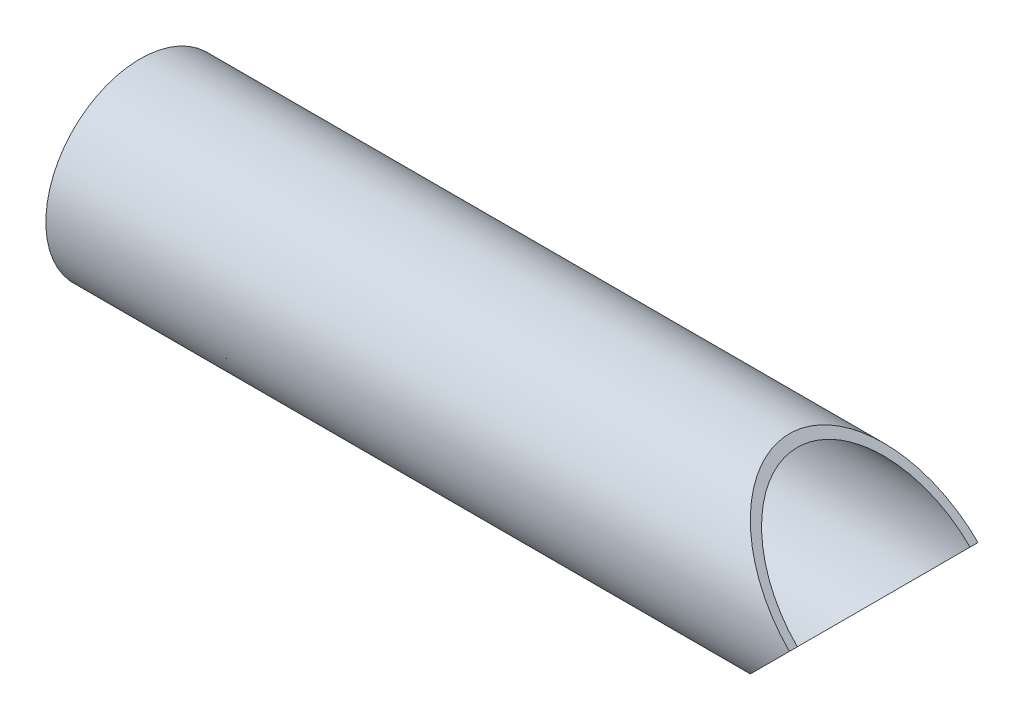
SolidWorks part; units mm, degrees
ref_plane "Plan de face" through (0, 0, 0) normal (0, 0, 1) x (1, 0, 0)
ref_plane "Plan de dessus" through (0, 0, 0) normal (0, 1, 0) x (1, 0, 0)
ref_plane "Plan de droite" through (0, 0, 0) normal (1, 0, 0) x (0, 0, -1)
sketch "Esquisse1" plane through (0, 0, 0) normal (0, 0, 1) x (1, 0, 0)
  line L0 (0, 0) -> (300, 0)
  dimension "D1" = 300
ref_plane "Plan1" through (300, 0, 0) normal (1, 0, 0) x (0, 0, -1)
sketch "Esquisse2" plane through (300, 0, 0) normal (1, 0, 0) x (0, 0, -1)
  circle A0 centre (0, 0) radius 34.85
  dimension "D1" = 69.7
sweep "Balayage-Mince2" add profiles "Esquisse2" path "Esquisse1" parameters "D1"=3.2
sketch "Esquisse5" plane through (0, 0, 0) normal (0, 0, 1) x (1, 0, 0)
  line L0 (300, 0) -> (222.2238, -77.7762)
  line L1 (300, 0) -> (222.5469, 77.4531)
  line L2 (222.5469, 77.4531) -> (309.5962, 77.4531)
  line L3 (309.5962, 77.4531) -> (309.5962, -77.7762)
  line L4 (222.2238, -77.7762) -> (309.5962, -77.7762)
  line L5 (300, -38.05) -> (300, 38.05) construction
  dimension "D1" = 45
  dimension "D2" = 45
extrude "Enlèv. mat.-Extru.1" cut sketch "Esquisse5" against normal mid plane 80
